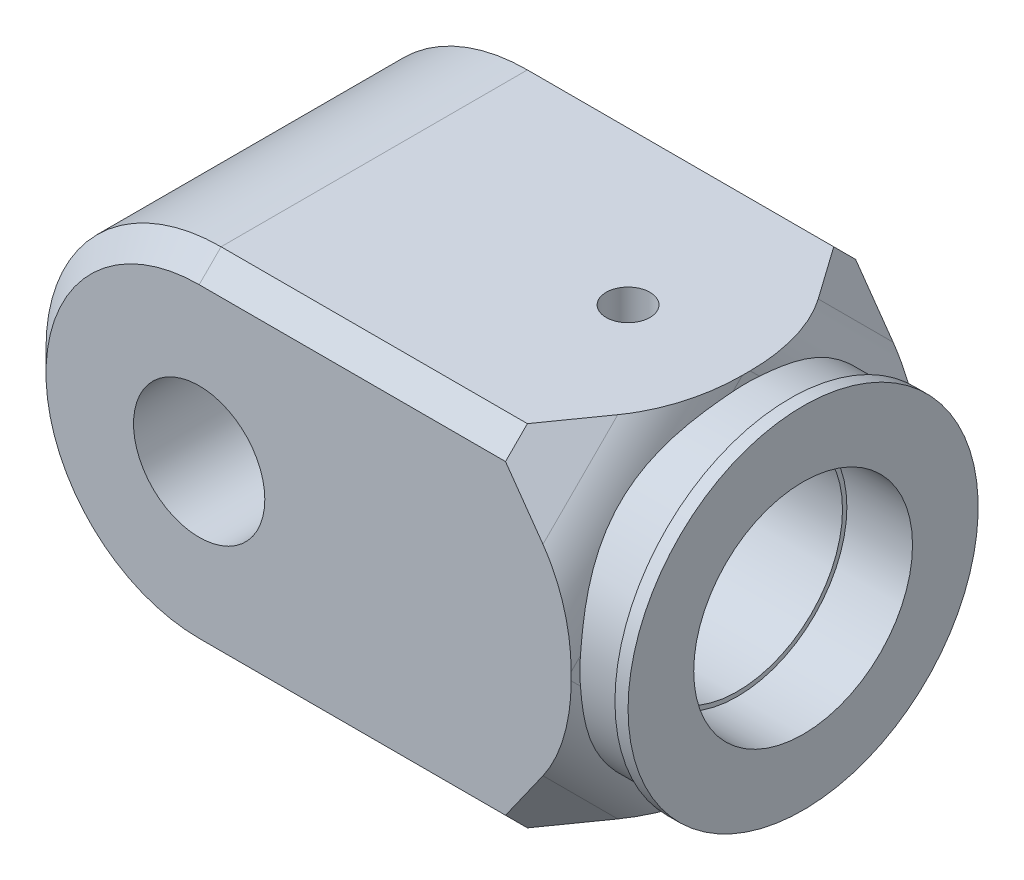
SolidWorks part; units mm, degrees
ref_plane "Plan de face" through (0, 0, 0) normal (0, 0, 1) x (1, 0, 0)
ref_plane "Plan de dessus" through (0, 0, 0) normal (0, 1, 0) x (1, 0, 0)
ref_plane "Plan de droite" through (0, 0, 0) normal (1, 0, 0) x (0, 0, -1)
sketch "Esquisse1" plane through (0, 0, 0) normal (0, 0, 1) x (1, 0, 0)
  line L0 (-40, 0) -> (35, 0)
  line L1 (40, 22.16) -> (40, 25)
  line L2 (40, 22.16) -> (83, 22.16)
  line L4 (0, 40) -> (85, 40)
  line L6 (35, 0) -> (35, 25)
  line L9 (35, 25) -> (40, 25)
  line L16 (83, 22.16) -> (83, 25)
  line L20 (98, 25) -> (98, 40)
  line L21 (83, 25) -> (98, 25)
  line L22 (95, 40) -> (98, 40)
  line L27 (85, 38) -> (85, 40)
  line L28 (95, 38) -> (95, 40)
  line L29 (85, 38) -> (95, 38)
  line L30 (-67.3273, 0) -> (137.0317, 0) construction
  arc A0 (0, 40) -> (-40, 0) centre (0, 0) ccw
revolve "Révolution1" add sketch "Esquisse1" angle 360 about L30
sketch "Esquisse2" plane through (0, 0, 0) normal (0, 1, 0) x (1, 0, 0)
  line L0 (16.3641, 0) -> (116.0155, 0) construction
  line L1 (98, -40) -> (98, 40) construction
  circle A0 centre (58, 0) radius 4.5
  dimension "D1" = 9
  dimension "D2" = 40
extrude "Extrusion1" cut sketch "Esquisse2" against normal mid plane 170
sketch "Esquisse3" plane through (0, 0, 0) normal (0, 0, 1) x (1, 0, 0)
  circle A0 centre (0, 0) radius 15
  dimension "D1" = 30
extrude "Extrusion2" cut sketch "Esquisse3" against normal mid plane 104
sketch "Esquisse4" plane through (0, 0, 0) normal (0, 0, 1) x (1, 0, 0)
  line L0 (0, -40) -> (53.5, -40) construction
  line L1 (62.5, -40) -> (85, -40) construction
  line L2 (85, 40) -> (62.5, 40) construction
  line L3 (53.5, 40) -> (0, 40) construction
  line L4 (0, -40) -> (62.5, -40)
  line L5 (62.5, -40) -> (85, -40)
  line L6 (85, 40) -> (62.5, 40)
  line L7 (62.5, 40) -> (0, 40)
  line L8 (85, 40) -> (85, -40)
  arc A0 (0, 40) -> (0, -40) centre (0, 0) ccw construction
  arc A1 (0, 40) -> (0, -40) centre (0, 0) ccw
  circle A2 centre (0, 0) radius 15
extrude "Extrusion3" add sketch "Esquisse4" along normal mid plane 80
chamfer "Chanfrein1" distance 5 angle 45 6 edges at (42.5, -40, -40) (-40, 0, -40) (42.5, 40, -40) (42.5, -40, 40) (-40, 0, 40) (42.5, 40, 40)
sketch "Esquisse5" plane through (85, 0, 0) normal (1, 0, 0) x (0, 0, -1)
  circle A0 centre (0, 0) radius 25
extrude "Extrusion4" cut sketch "Esquisse5" against normal blind 2
sketch "Esquisse6" plane through (83, 0, 0) normal (1, 0, 0) x (0, 0, -1)
  circle A0 centre (0, 0) radius 24
  dimension "D1" = 48
extrude "Extrusion5" cut sketch "Esquisse6" against normal blind 43
sketch "Esquisse7" plane through (40, 0, 0) normal (1, 0, 0) x (0, 0, -1)
  circle A0 centre (0, 0) radius 25
  dimension "D1" = 50
extrude "Extrusion6" cut sketch "Esquisse7" against normal blind 5
sketch "Esquisse8" plane through (0, 40, 0) normal (0, 1, 0) x (1, 0, 0)
  line L0 (0, 0) -> (76.3942, 0) construction
  line L1 (98, -40) -> (98, 40) construction
  circle A0 centre (58, 0) radius 5
  dimension "D1" = 10
  dimension "D2" = 40
extrude "Extrusion7" cut sketch "Esquisse8" against normal blind 84
chamfer "Chanfrein2" distance 15 angle 45 4 edges at (85, -37.5, 37.5) (85, -37.5, -37.5) (85, 37.5, -37.5) (85, 37.5, 37.5)
fillet "Congé2" radius 22 4 edges at (85, 26.8934, -26.8934) (85, -26.8934, -26.8934) (85, -26.8934, 26.8934) (85, 26.8934, 26.8934)
